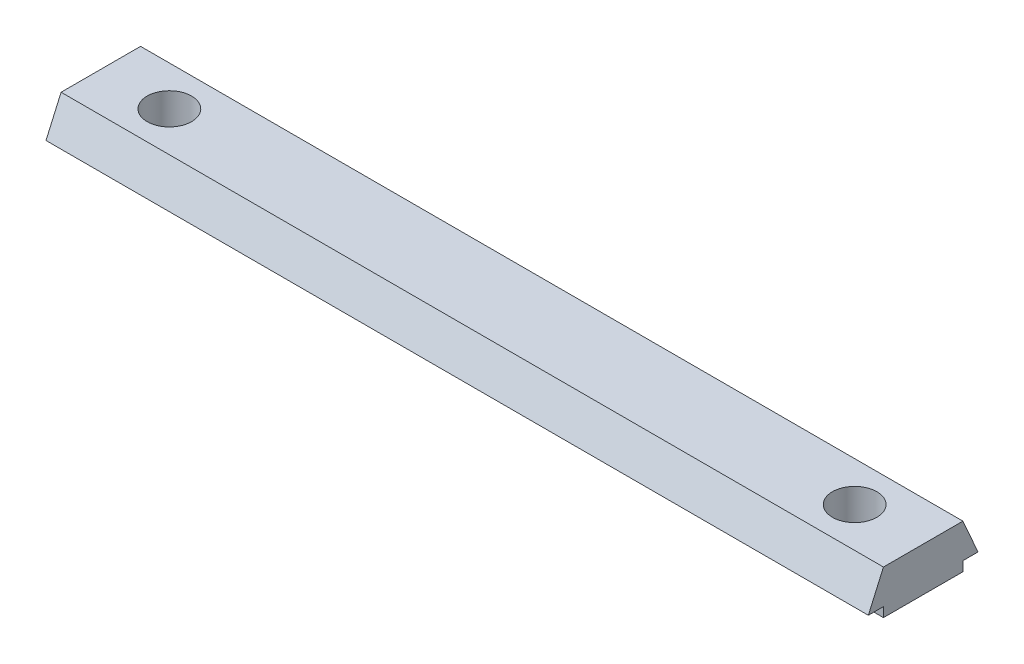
SolidWorks part; units mm, degrees
ref_plane "Front Plane" through (0, 0, 0) normal (0, 0, 1) x (1, 0, 0)
ref_plane "Top Plane" through (0, 0, 0) normal (0, 1, 0) x (1, 0, 0)
ref_plane "Right Plane" through (0, 0, 0) normal (1, 0, 0) x (0, 0, -1)
sketch "Sketch1" plane through (0, 0, 0) normal (1, 0, 0) x (0, 0, -1)
  line L0 (-2.9, 0) -> (2.9, 0)
  line L1 (2.9, 0) -> (2.9, 0.7)
  line L2 (-2.9, 0) -> (-2.9, 0.7)
  line L3 (-2.9, 0.7) -> (-4, 0.7)
  line L4 (-4, 0.7) -> (-2.9, 3.2)
  line L5 (-2.9, 3.2) -> (2.9, 3.2)
  line L6 (2.9, 3.2) -> (4, 0.7)
  line L7 (4, 0.7) -> (2.9, 0.7)
  line L8 (0, 0) -> (0, 3.2) construction
  dimension "A" = 5.8
  dimension "B" = 8
  dimension "T" = 3.2
  dimension "E" = 2.5
extrude "Boss-Extrude1" add sketch "Sketch1" along normal blind 60
hole_wizard "Tapped Hole1" positions "Sketch3" profile "Sketch2" tap size "M4x0.7" standard "Jis"
sketch "Sketch3" plane through (0, 3.2, 0) normal (0, 1, 0) x (1, 0, 0)
  point P0 (5, 0)
  dimension "N" = 5
sketch "Sketch2" plane through (5, 3.2, 0) normal (1, 0, 0) x (0, 0, 1)
  line L0 (0, 0) -> (0, 3.2)
  line L1 (0, 3.2) -> (1.621, 3.2)
  line L2 (1.621, 3.2) -> (1.621, 0)
  line L5 (1.621, 0) -> (0, 0)
  line L11 (0, -6.35) -> (0, 107.95) construction
  dimension "Thru Tap Drill Dia." = 3.242
  dimension "Thru Tap Drill Depth" = 3.2
pattern_linear "LPattern1" count 2 spacing 50 along (1, 0, 0) of "Tapped Hole1"
